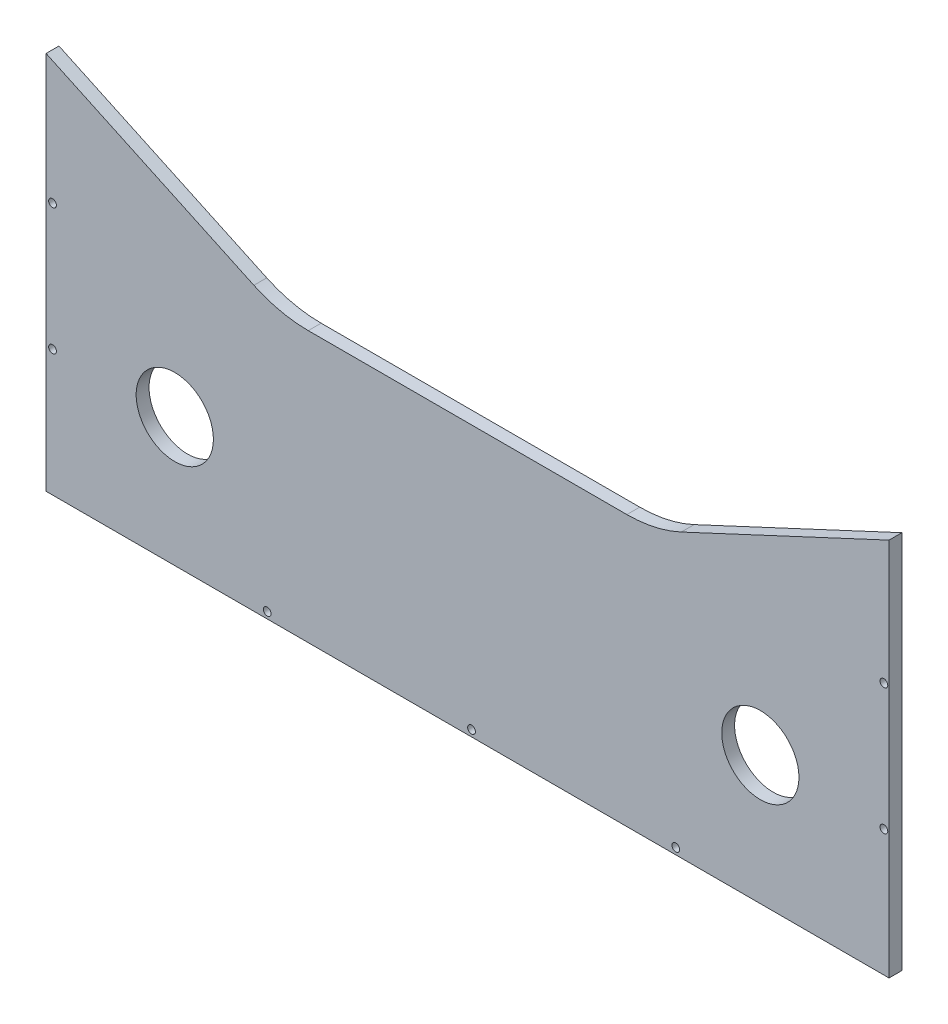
SolidWorks part; units mm, degrees
ref_plane "Front Plane" through (0, 0, 0) normal (0, 0, 1) x (1, 0, 0)
ref_plane "Top Plane" through (0, 0, 0) normal (0, 1, 0) x (1, 0, 0)
ref_plane "Right Plane" through (0, 0, 0) normal (1, 0, 0) x (0, 0, -1)
ref_plane "Plane1" through (0, 0, 0) normal (0, 0, -1) x (-1, 0, 0)
sketch "Sketch1" plane through (0, 0, 0) normal (0, 0, -1) x (-1, 0, 0)
  line L0 (-163.75, -52.5) -> (163.75, -52.5)
  line L1 (163.75, -52.5) -> (163.75, 94.83)
  line L2 (163.75, 94.83) -> (83.0192, 57.1846)
  line L3 (61.8883, 52.5) -> (-61.8883, 52.5)
  line L4 (-83.0192, 57.1846) -> (-163.75, 94.83)
  line L5 (-163.75, 94.83) -> (-163.75, -52.5)
  circle A0 centre (161.75, -3.39) radius 1.5
  circle A1 centre (0, -50.5) radius 1.5
  arc A2 (83.0192, 57.1846) -> (61.8883, 52.5) centre (61.8883, 102.5) cw
  arc A3 (-61.8883, 52.5) -> (-83.0192, 57.1846) centre (-61.8883, 102.5) cw
  circle A4 centre (113.75, -2.5) radius 15
  circle A5 centre (-113.75, -2.5) radius 15
  circle A6 centre (161.75, 45.72) radius 1.5
  circle A7 centre (-161.75, 45.72) radius 1.5
  circle A8 centre (-161.75, -3.39) radius 1.5
  circle A9 centre (-81.875, -50.5) radius 1.5
  circle A10 centre (81.875, -50.5) radius 1.5
extrude "Boss-Extrude1" add sketch "Sketch1" against normal blind 5
sketch "Sketch2" plane through (0, 0, 5) normal (0, 0, 1) x (1, 0, 0)
  circle A0 centre (-161.75, 45.72) radius 1.5
  circle A1 centre (-161.75, 45.72) radius 1.5 construction
  circle A2 centre (-161.75, -3.39) radius 1.5
  circle A3 centre (-81.875, -50.5) radius 1.5
  circle A4 centre (0, -50.5) radius 1.5
  circle A5 centre (81.875, -50.5) radius 1.5
extrude "Boss-Extrude2" add sketch "Sketch2" against normal blind 5
sketch "Sketch3" plane through (0, 0, 5) normal (0, 0, 1) x (1, 0, 0)
  line L0 (-161.25, -1.89) -> (-158.75, -1.89) construction
  line L1 (-158.75, -1.89) -> (-158.75, -4.89) construction
  line L2 (-158.75, -4.89) -> (-161.25, -4.89) construction
  line L3 (-161.25, 47.22) -> (-158.75, 47.22) construction
  line L4 (-158.75, 47.22) -> (-158.75, 44.22) construction
  line L5 (-158.75, 44.22) -> (-161.25, 44.22) construction
  line L6 (-161.25, 44.22) -> (-161.25, -1.89) construction
  line L7 (-161.25, -4.89) -> (-161.25, -52.5) construction
  line L8 (-161.25, -52.5) -> (-79.3382, -52.5) construction
  line L9 (-79.3382, -52.5) -> (-79.3382, -47.5) construction
  line L10 (-79.3382, -47.5) -> (-76.3382, -47.5) construction
  line L11 (-76.3382, -47.5) -> (-76.3382, -50) construction
  line L12 (-76.3382, -50) -> (0.0368, -50) construction
  line L13 (0.0368, -52.5) -> (0.0368, -50) construction
  line L14 (0.0368, -50) -> (0.0368, -47.5) construction
  line L15 (0.0368, -47.5) -> (3.0368, -47.5) construction
  line L16 (3.0368, -47.5) -> (3.0368, -50) construction
  line L17 (3.0368, -50) -> (79.4118, -50) construction
  line L18 (79.4118, -50) -> (79.4118, -47.5) construction
  line L19 (79.4118, -47.5) -> (82.4118, -47.5) construction
  line L20 (82.4118, -47.5) -> (82.4118, -50) construction
  line L21 (82.4118, -50) -> (165.2868, -50) construction
  line L22 (163.75, -52.5) -> (-163.75, -52.5) construction
  line L23 (-163.75, -52.5) -> (-163.75, 94.83) construction
  line L24 (-161.25, 47.22) -> (-161.25, 44.22) construction
  line L25 (-161.25, -1.89) -> (-161.25, -4.89) construction
  line L27 (-79.3382, -50) -> (-76.3382, -50) construction
  line L28 (-76.3382, -50) -> (0.0368, -50) construction
  line L29 (0.0368, -50) -> (3.0368, -50) construction
  line L30 (3.0368, -50) -> (79.4118, -50) construction
  line L31 (79.4118, -50) -> (82.4118, -50) construction
  circle A0 centre (80.9118, -50) radius 1.5
  circle A1 centre (1.5368, -50) radius 1.5
  circle A2 centre (-77.8382, -50) radius 1.5
  circle A3 centre (-161.25, -3.39) radius 1.5
  circle A4 centre (-161.25, 45.72) radius 1.5
  dimension "D1" = 2.5
extrude "Cut-Extrude1" cut sketch "Sketch3" against normal blind 5 contours A4 | A3 | A2 | A1 | A0
